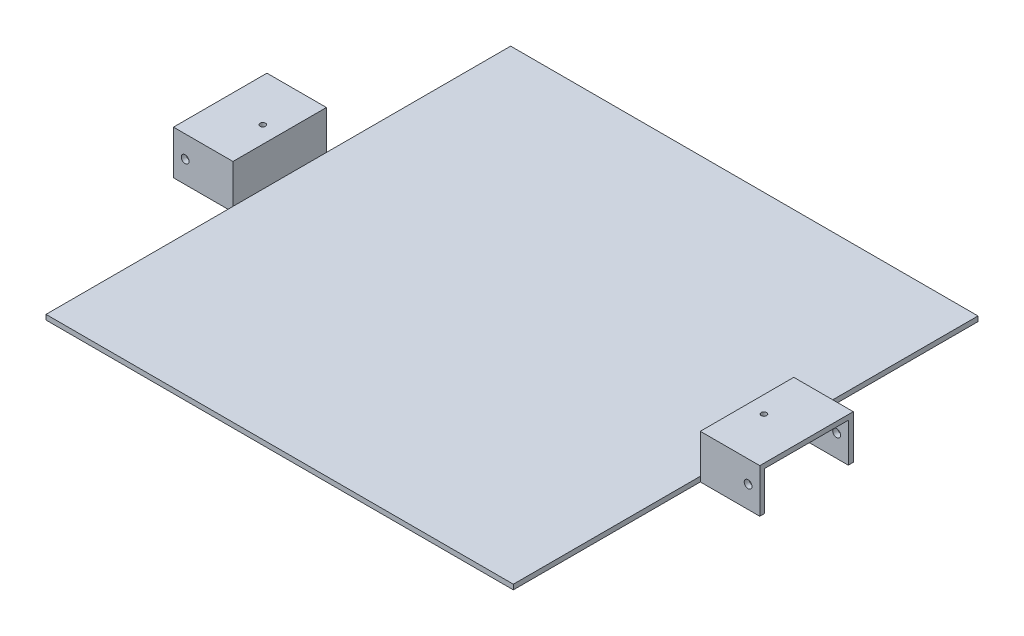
SolidWorks part; units mm, degrees
ref_plane "Front Plane" through (0, 0, 0) normal (0, 0, 1) x (1, 0, 0)
ref_plane "Top Plane" through (0, 0, 0) normal (0, 1, 0) x (1, 0, 0)
ref_plane "Right Plane" through (0, 0, 0) normal (1, 0, 0) x (0, 0, -1)
sketch "Sketch2" plane through (0, 0, 0) normal (0, 1, 0) x (1, 0, 0)
  line L1 (300, -300) -> (-300, -300)
  line L2 (300, -300) -> (300, 296.5)
  line L3 (300, 296.5) -> (-300, 296.5)
  line L4 (-300, -300) -> (-300, 296.5)
  point P0 (0, 0)
  dimension "D1" = 600
  dimension "D2" = 596.5
  dimension "D3" = 300
base flange "Base-Flange1" sketch "Sketch2" thickness 6.35 reverse thickness direction no parameters "D1"=10
sketch "Sketch8" plane through (-300, 0, 0) normal (-1, 0, 0) x (0, 0, 1)
  line L1 (-60, -6.35) -> (60, -6.35)
  line L2 (-60, -6.35) -> (-60, 50)
  line L3 (-60, 50) -> (60, 50)
  line L4 (60, -6.35) -> (60, 50)
  line L5 (-296.5, 0) -> (300, 0) construction
  line L6 (-296.5, -6.35) -> (300, -6.35) construction
  point P4 (0, -6.35)
  point P6 (0, 0)
  point P11 (0, 0)
  point P13 (0, 0)
  dimension "D1" = 120
  dimension "D2" = 50
  dimension "D3" = 300
base flange "Base-Flange2" sketch "Sketch8" thickness 6.35 reverse thickness direction yes parameters "D1"=10
sketch "Sketch34" plane through (-306.35, 0, 0) normal (-1, 0, 0) x (0, 0, 1)
  line L0 (-53.65, 43.65) -> (-53.65, -6.35)
  line L1 (-60, 50) -> (60, 50)
  line L2 (-60, 50) -> (-60, -6.35)
  line L4 (60, 50) -> (60, -6.35)
  line L5 (-53.65, 43.65) -> (53.65, 43.65)
  line L6 (53.65, 43.65) -> (53.65, -6.35)
  line L7 (-60, -6.35) -> (-53.65, -6.35)
  line L8 (60, -6.35) -> (53.65, -6.35)
  dimension "D1" = 6.35
extrude "Boss-Extrude1" add sketch "Sketch34" along normal blind 70
sketch "Sketch33" plane through (0, 0, -60) normal (0, 0, -1) x (-1, 0, 0)
  line L0 (386.35, 21.825) -> (376.35, 21.825) construction
  line L4 (300, 50) -> (300, -6.35) construction
  line L6 (376.35, 50) -> (376.35, -6.35) construction
  circle A0 centre (361.35, 21.825) radius 25 construction
  circle A1 centre (361.35, 21.825) radius 5
  point P6 (300, 21.825)
  dimension "D2" = 50
  dimension "D3" = 10
  dimension "D1" = 10
extrude "Cut-Extrude1" cut sketch "Sketch33" against normal up to surface (120 mm away)
sketch "Sketch38" plane through (0, 50, 0) normal (0, 1, 0) x (1, 0, 0)
  line L0 (-338.175, 60) -> (-338.175, -60) construction
  line L1 (-376.35, 60) -> (-300, 60) construction
  line L2 (-376.35, -60) -> (-300, -60) construction
  line L3 (-338.175, 0) -> (-321.675, 0) construction
  circle A1 centre (-321.675, 0) radius 3.5
  point P8 (-325.175, 0)
  point P10 (-1298.3354, 286.2456)
  dimension "D2" = 7
  dimension "D1" = 13
extrude "Cut-Extrude2" cut sketch "Sketch38" against normal up to next
mirror "Mirror1" about plane through (0, 0, 0) normal (1, 0, 0)
sketch "Sketch37" plane through (0, -6.35, 0) normal (0, -1, 0) x (1, 0, 0)
  line L0 (-306.35, -53.65) -> (-306.35, 53.65) construction
  line L1 (-306.35, 30) -> (-266.35, 30)
  line L2 (-306.35, 30) -> (-306.35, -30)
  line L3 (-306.35, -30) -> (-266.35, -30)
  line L4 (-266.35, 30) -> (-266.35, -30)
  point P6 (-306.35, 0)
  point P7 (-266.35, 0)
  dimension "D1" = 40
  dimension "D2" = 60
sketch "Bend-Lines1" [suppressed] plane through (0, 0, 0) normal (0, 1, 0) x (1, 0, 0)
sketch "Bounding-Box1" [suppressed] plane through (0, 0, 0) normal (0, 1, 0) x (1, 0, 0)
sheet metal parameters "Sheet-Metal1" thickness 6.35 parameters "D1"=10
flat pattern "Flat-Pattern1"
sketch "Bend-Lines2" plane through (0, 0, 0) normal (0, 1, 0) x (1, 0, 0)
sketch3d "Bounding-Box2" [suppressed]
  line L0 (300, -300, 0) -> (-300, -300, 0) construction
  line L1 (300, 296.5, 0) -> (-300, 296.5, 0) construction
  line L2 (300, -300, 0) -> (300, 296.5, 0) construction
  line L3 (-300, -300, 0) -> (-300, 296.5, 0) construction
sheet metal parameters "Sheet-Metal2" thickness 6.35 parameters "D1"=10
flat pattern "Flat-Pattern2"
sketch "Bend-Lines3" plane through (0, 0, 0) normal (0, 1, 0) x (1, 0, 0)
sketch3d "Bounding-Box3" [suppressed]
  line L0 (-60, -6.35, 0) -> (60, -6.35, 0) construction
  line L1 (-60, 50, 0) -> (60, 50, 0) construction
  line L2 (-60, -6.35, 0) -> (-60, 50, 0) construction
  line L3 (60, -6.35, 0) -> (60, 50, 0) construction
sheet metal parameters "Sheet-Metal9" thickness 6.35 parameters "D1"=10
flat pattern "Flat-Pattern2"
sketch "Bend-Lines3" plane through (0, 0, 0) normal (0, 1, 0) x (1, 0, 0)
sketch3d "Bounding-Box3" [suppressed]
  line L0 (-60, -6.35, 0) -> (60, -6.35, 0) construction
  line L1 (-60, 50, 0) -> (60, 50, 0) construction
  line L2 (-60, -6.35, 0) -> (-60, 50, 0) construction
  line L3 (60, -6.35, 0) -> (60, 50, 0) construction
sheet metal parameters "Sheet-Metal10" thickness 6.35 parameters "D1"=10
flat pattern "Flat-Pattern2"
sketch "Bend-Lines3" plane through (0, 0, 0) normal (0, 1, 0) x (1, 0, 0)
sketch3d "Bounding-Box3" [suppressed]
  line L0 (-60, -6.35, 0) -> (60, -6.35, 0) construction
  line L1 (-60, 50, 0) -> (60, 50, 0) construction
  line L2 (-60, -6.35, 0) -> (-60, 50, 0) construction
  line L3 (60, -6.35, 0) -> (60, 50, 0) construction
sheet metal parameters "Sheet-Metal11" thickness 6.35 parameters "D1"=10
flat pattern "Flat-Pattern11"
sketch "Bend-Lines8" plane through (0, 0, 0) normal (0, 1, 0) x (1, 0, 0)
sketch3d "Bounding-Box8" [suppressed]
  line L0 (-53.65, 43.65, 0) -> (53.65, 43.65, 0) construction
  line L1 (-53.65, -6.35, 0) -> (53.65, -6.35, 0) construction
  line L2 (-53.65, 43.65, 0) -> (-53.65, -6.35, 0) construction
  line L3 (53.65, 43.65, 0) -> (53.65, -6.35, 0) construction
sheet metal parameters "Sheet-Metal14" thickness 6.35 parameters "D1"=10
flat pattern "Flat-Pattern2"
sketch "Bend-Lines3" plane through (0, 0, 0) normal (0, 1, 0) x (1, 0, 0)
sketch3d "Bounding-Box3" [suppressed]
  line L0 (-61.75, -6.35, 0) -> (58.25, -6.35, 0) construction
  line L1 (-61.75, 50, 0) -> (58.25, 50, 0) construction
  line L2 (-61.75, -6.35, 0) -> (-61.75, 50, 0) construction
  line L3 (58.25, -6.35, 0) -> (58.25, 50, 0) construction
